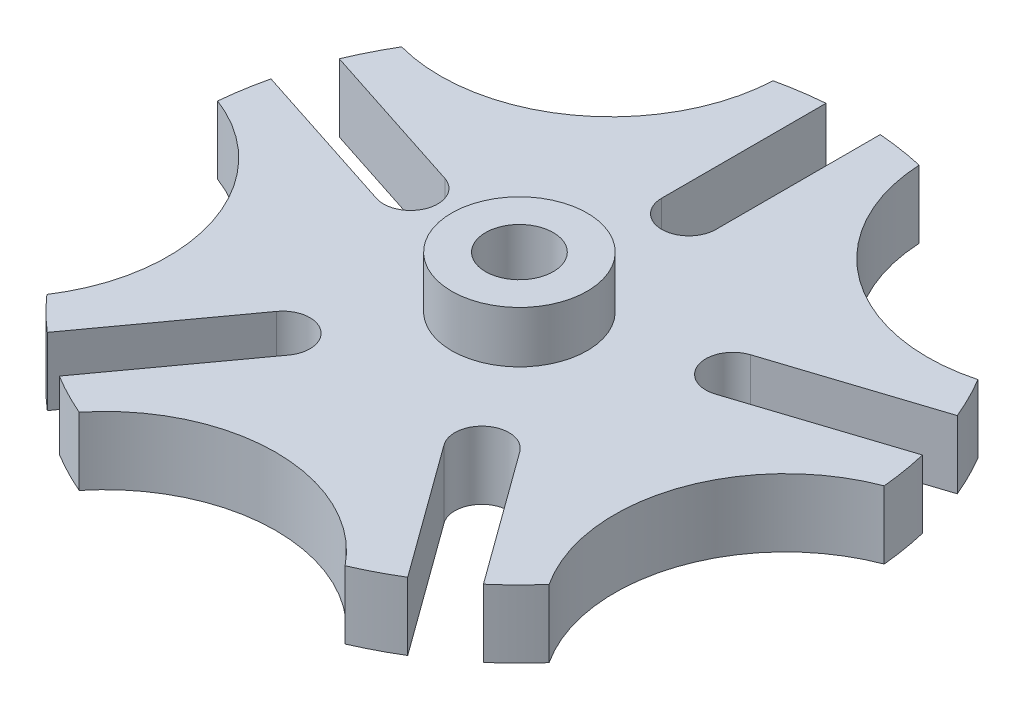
SolidWorks part; units mm, degrees
ref_plane "Front" through (0, 0, 0) normal (0, 0, 1) x (1, 0, 0)
ref_plane "Top" through (0, 0, 0) normal (0, 1, 0) x (1, 0, 0)
ref_plane "Right" through (0, 0, 0) normal (1, 0, 0) x (0, 0, -1)
sketch "Sketch1" plane through (0, 0, 0) normal (0, 1, 0) x (1, 0, 0)
  circle A0 centre (0, 0) radius 31.369
  dimension "D1" = 62.738
extrude "Extrude1" add sketch "Sketch1" along normal mid plane 6.35
sketch "Sketch2" plane through (0, 3.175, 0) normal (0, 1, 0) x (-1, 0, 0)
  line L0 (0, -15.875) -> (0, -31.369) construction
  line L1 (-2.54, -15.875) -> (-2.54, -31.266)
  line L2 (2.54, -15.875) -> (2.54, -31.266)
  line L3 (-2.54, -15.875) -> (-2.54, -36.0737) construction
  line L4 (0, -15.875) -> (0, -36.0737) construction
  line L5 (2.54, -15.875) -> (2.54, -36.0737) construction
  circle A0 centre (0, 0) radius 15.875 construction
  arc A1 (-2.54, -15.875) -> (2.54, -15.875) centre (0, -15.875) cw
  circle A3 centre (0, 0) radius 31.369 construction
  arc A4 (-2.54, -31.266) -> (2.54, -31.266) centre (0, 0) ccw
  dimension "D1" = 31.75
  dimension "D2" = 2.54
  dimension "D3" = 2.54
extrude "Cut-Extrude1" cut sketch "Sketch2" against normal blind 6.35
pattern_circular "CirPattern1" count 5 over 360 about axis through (0, 0, 0) along (0, 1, 0) of "Cut-Extrude1"
sketch "Sketch3" plane through (0, 3.175, 0) normal (0, 1, 0) x (-1, 0, 0)
  line L0 (-2.54, -31.266) -> (-28.9508, -12.0774) construction
  line L1 (0, 0) -> (-15.7454, -21.6717) construction
  line L2 (-15.7454, -21.6717) -> (-22.8231, -31.4133) construction
  arc A0 (-6.8411, -30.6139) -> (-27.0016, -15.9665) centre (-22.8231, -31.4133) ccw
  arc A1 (-28.9508, -12.0774) -> (-2.54, -31.266) centre (0, 0) ccw construction
  arc A2 (-27.0016, -15.9665) -> (-6.8411, -30.6139) centre (0, 0) ccw
  dimension "D1" = 16.002
  dimension "D2" = 38.829
extrude "Cut-Extrude2" cut sketch "Sketch3" against normal through all
pattern_circular "CirPattern2" count 5 over 360 about axis through (0, 0, 0) along (0, 1, 0) of "Cut-Extrude2"
sketch "Sketch4" plane through (0, 3.175, 0) normal (0, 1, 0) x (-1, 0, 0)
  circle A0 centre (0, 0) radius 6.35
  circle A1 centre (0, 0) radius 3.175
  dimension "D1" = 6.35
  dimension "D2" = 12.7
extrude "Extrude2" add sketch "Sketch4" along normal blind 4.826
sketch "Sketch5" plane through (0, 3.175, 0) normal (0, 1, 0) x (-1, 0, 0)
  circle A1 centre (0, 0) radius 3.175
  circle A2 centre (0, 0) radius 3.175
  dimension "D1" = 0
extrude "Cut-Extrude3" cut sketch "Sketch5" against normal through all
